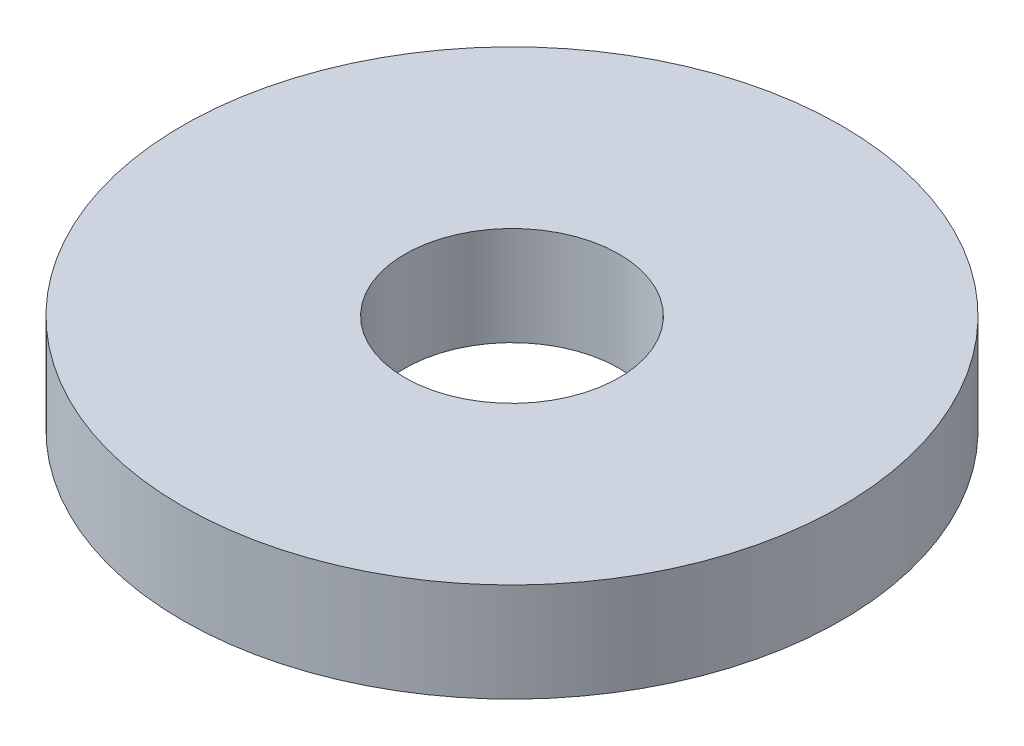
SolidWorks part; units mm, degrees
ref_plane "Plan de face" through (0, 0, 0) normal (0, 0, 1) x (1, 0, 0)
ref_plane "Plan de dessus" through (0, 0, 0) normal (0, 1, 0) x (1, 0, 0)
ref_plane "Plan de droite" through (0, 0, 0) normal (1, 0, 0) x (0, 0, -1)
sketch "Esquisse1" plane through (0, 0, 0) normal (0, 1, 0) x (1, 0, 0)
  circle A0 centre (0, 0) radius 10
  circle A1 centre (0, 0) radius 3.25
  dimension "D1" = 20
  dimension "D2" = 6.5
extrude "Extrusion1" add sketch "Esquisse1" along normal blind 3
